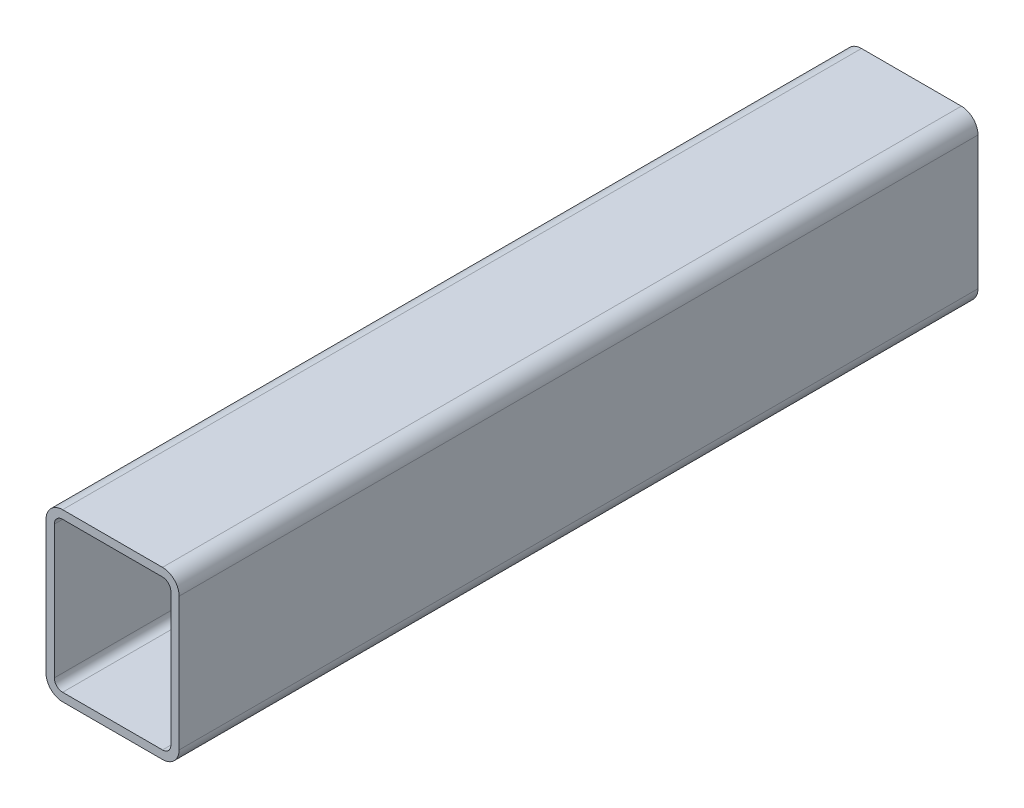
SolidWorks part; units mm, degrees
ref_plane "Front Plane" through (0, 0, 0) normal (0, 0, 1) x (1, 0, 0)
ref_plane "Top Plane" through (0, 0, 0) normal (0, 1, 0) x (1, 0, 0)
ref_plane "Right Plane" through (0, 0, 0) normal (1, 0, 0) x (0, 0, -1)
sketch "Sketch1" plane through (0, 0, 0) normal (0, 0, 1) x (1, 0, 0)
  line B0 (6.35, 63.5) -> (44.45, 63.5)
  arc B1 (50.8, 57.15) -> (44.45, 63.5) centre (44.45, 57.15) ccw
  line B2 (50.8, 57.15) -> (50.8, 6.35)
  arc B3 (44.45, 0) -> (50.8, 6.35) centre (44.45, 6.35) ccw
  line B4 (44.45, 0) -> (6.35, 0)
  arc B5 (0, 6.35) -> (6.35, 0) centre (6.35, 6.35) ccw
  line B6 (0, 6.35) -> (0, 57.15)
  arc B7 (6.35, 63.5) -> (0, 57.15) centre (6.35, 57.15) ccw
  line B8 (6.35, 60.325) -> (44.45, 60.325)
  arc B9 (47.625, 57.15) -> (44.45, 60.325) centre (44.45, 57.15) ccw
  line B10 (47.625, 57.15) -> (47.625, 6.35)
  arc B11 (44.45, 3.175) -> (47.625, 6.35) centre (44.45, 6.35) ccw
  line B12 (44.45, 3.175) -> (6.35, 3.175)
  arc B13 (3.175, 6.35) -> (6.35, 3.175) centre (6.35, 6.35) ccw
  line B14 (3.175, 6.35) -> (3.175, 57.15)
  arc B15 (6.35, 60.325) -> (3.175, 57.15) centre (6.35, 57.15) ccw
sketch_block_instance "HSS2.5x2x0.125-1"
sketch_block "HSS2.5x2x0.125"
extrude "Boss-Extrude1" add sketch "Sketch1" along normal blind 304.8
